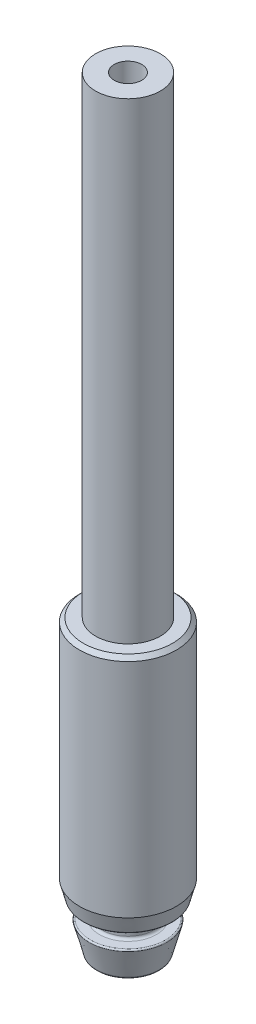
SolidWorks part; units mm, degrees
ref_plane "Front Plane" through (0, 0, 0) normal (0, 0, 1) x (1, 0, 0)
ref_plane "Top Plane" through (0, 0, 0) normal (0, 1, 0) x (1, 0, 0)
ref_plane "Right Plane" through (0, 0, 0) normal (1, 0, 0) x (0, 0, -1)
sketch "layout" plane through (0, 0, 0) normal (0, 0, 1) x (1, 0, 0)
  line L0 (0, 0) -> (0, 7.8189) construction
  line L1 (0, 0) -> (3.048, 0)
  line L2 (3.048, 0) -> (4.7625, 6.3986)
  line L3 (4.7625, 6.3986) -> (4.7625, 28.575)
  line L5 (0, 28.575) -> (0, 0)
  line L6 (4.332, 4.792) -> (2.5419, 4.792)
  line L7 (2.5419, 4.792) -> (2.5419, 3.014)
  line L8 (2.5419, 3.014) -> (3.8556, 3.014)
  line L9 (3.0607, 3.8395) -> (3.0607, 3.014) construction
  line L10 (3.0607, 3.8395) -> (2.2352, 3.8395) construction
  line L11 (0, 28.575) -> (4.7625, 28.575)
  line L17 (0, 28.575) -> (3.175, 28.575)
  line L18 (0, 28.575) -> (0, 74.93)
  line L19 (0, 74.93) -> (3.175, 74.93)
  line L20 (3.175, 28.575) -> (3.175, 74.93)
  line L22 (3.175, 0.474) -> (0, 0.474) construction
  circle A0 centre (3.0607, 3.8395) radius 0.8255
  dimension "D6" = 1.651
  dimension "D1" = 15
  dimension "D2" = 6.096
  dimension "D3" = 9.525
  dimension "D4" = 28.575
  dimension "D5" = 1.778
  dimension "D7" = 2.54
  dimension "D8" = 5.0837
  dimension "D9" = 4.4704
  dimension "D10" = 74.93
  dimension "D11" = 6.35
  dimension "D14" = 6.35
  dimension "D15" = 1.6066
sketch "Sketch10" plane through (0, 0, 0) normal (0, 0, 1) x (1, 0, 0)
  line L0 (4.7625, 6.3986) -> (4.7625, 28.575) construction
  line L2 (0, 28.575) -> (0, 0) construction
  line L3 (0, 0) -> (3.048, 0) construction
  line L4 (3.048, 0) -> (4.7625, 6.3986) construction
  line L7 (0, 28.575) -> (4.7625, 28.575) construction
  line L8 (4.7625, 6.3986) -> (4.7625, 28.575)
  line L10 (0, 28.575) -> (0, 0)
  line L11 (0, 0) -> (3.048, 0)
  line L12 (3.048, 0) -> (4.7625, 6.3986)
  line L15 (0, 28.575) -> (4.7625, 28.575)
revolve "Revolve1" add sketch "Sketch10" angle 360 about L0
sketch "Sketch12" plane through (0, 0, 0) normal (0, 0, 1) x (1, 0, 0)
  line L0 (3.175, 28.575) -> (3.175, 74.93) construction
  line L1 (0, 28.575) -> (3.175, 28.575) construction
  line L2 (0, 74.93) -> (3.175, 74.93) construction
  line L3 (0, 28.575) -> (0, 74.93) construction
  line L4 (3.175, 28.575) -> (3.175, 74.93)
  line L5 (0, 28.575) -> (3.175, 28.575)
  line L6 (0, 74.93) -> (3.175, 74.93)
  line L7 (0, 28.575) -> (0, 74.93)
revolve "Revolve2" add sketch "Sketch12" angle 360 about L0
hole_wizard "#6-32 Tapped Hole1" positions "Sketch6" profile "Sketch7" tap size "#6-32" standard "ANSI Inch"
sketch "Sketch6" plane through (0, 74.93, 0) normal (0, 1, 0) x (1, 0, 0)
  point P0 (0, 0)
sketch "Sketch7" plane through (0, 74.93, 0) normal (1, 0, 0) x (0, 0, 1)
  line L0 (0, 0) -> (0, 10.2107)
  line L1 (0, 10.2107) -> (1.3525, 9.398)
  line L2 (1.3525, 9.398) -> (1.3525, 0)
  line L5 (1.3525, 0) -> (0, 0)
  line L10 (0, 10.2107) -> (-1.3526, 9.398) construction
  line L11 (0, -6.35) -> (0, 107.95) construction
  dimension "Tap Drill Dia." = 2.7051
  dimension "Tap Drill Depth" = 9.398
  dimension "Drill Angle" = 118
chamfer "Chamfer2" distance 0.381 angle 45 1 edges at (0, 28.575, -4.7625)
sketch "Sketch11" plane through (0, 0, 0) normal (0, 0, 1) x (1, 0, 0)
  line L0 (2.5419, 3.014) -> (3.8556, 3.014) construction
  line L1 (4.332, 4.792) -> (2.5419, 4.792) construction
  line L2 (2.5419, 4.792) -> (2.5419, 3.014) construction
  line L3 (2.5419, 3.014) -> (3.8556, 3.014)
  line L4 (4.332, 4.792) -> (2.5419, 4.792)
  line L5 (2.5419, 4.792) -> (2.5419, 3.014)
  line L6 (4.332, 4.792) -> (3.8556, 3.014)
revolve "o-ring_groove" cut sketch "Sketch11" angle 360 about L0
fillet "o-ring_external_radius" radius 0.127 2 edges at (0, 4.792, -4.332) (0, 3.014, -3.8556)
fillet "o-ring_internal_radius" radius 0.254 2 edges at (0, 3.014, -2.5419) (0, 4.792, -2.5419)
fillet "Fillet4" radius 0.254 1 edges at (0, 0, -3.048)
